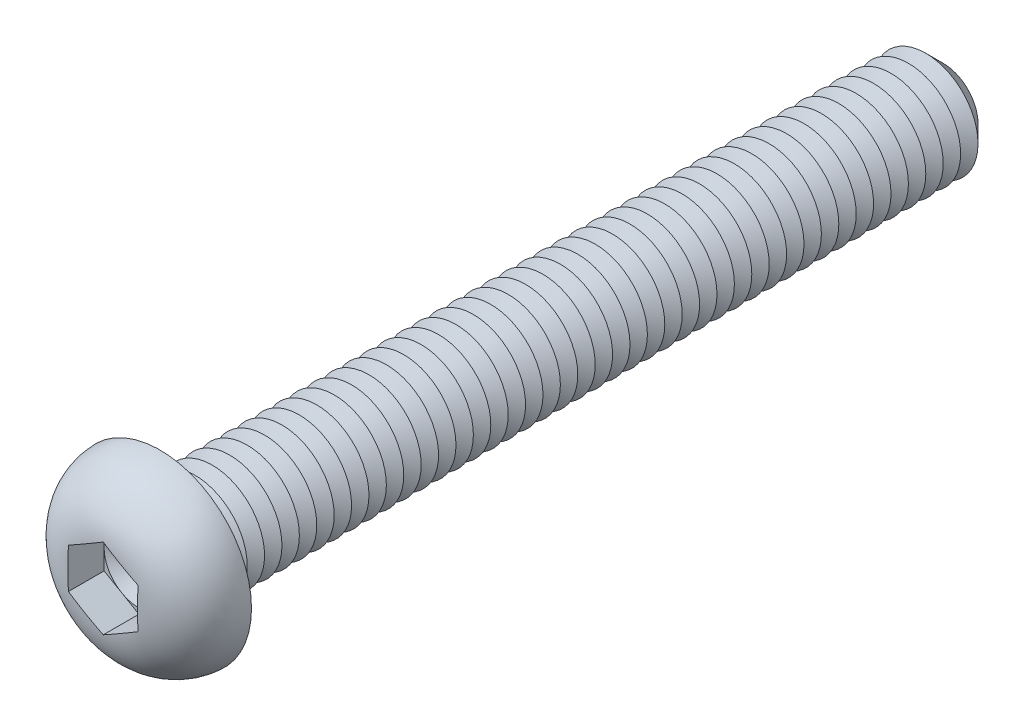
SolidWorks part; units mm, degrees
ref_plane "Front Plane" through (0, 0, 0) normal (0, 0, 1) x (1, 0, 0)
ref_plane "Top Plane" through (0, 0, 0) normal (0, 1, 0) x (1, 0, 0)
ref_plane "Right Plane" through (0, 0, 0) normal (1, 0, 0) x (0, 0, -1)
sketch "Sketch1" plane through (0, 0, 0) normal (1, 0, 0) x (0, 0, -1)
  line L0 (-47.9342, 0) -> (60.3146, 0) construction
sketch "Sketch2" plane through (0, 0, 0) normal (1, 0, 0) x (0, 0, -1)
  line L0 (0, 0) -> (-3.3, 0)
  line L1 (-47.9342, 0) -> (60.3146, 0) construction
  line L2 (-3.3, 0) -> (-3.3, 1.8515)
  line L3 (0, 5.25) -> (0, 0)
  arc A0 (-3.3, 1.8515) -> (0, 5.25) centre (0.1, 1.8515) cw
  dimension "D1" = 3.4
  dimension "D2" = 3.3
  dimension "D3" = 5.25
revolve "Revolve1" add sketch "Sketch2" angle 360 about L0
sketch "Sketch3" plane through (0, 0, 3.3) normal (0, 0, 1) x (1, 0, 0)
  line L1 (0, 2.3094) -> (-2, 1.1547)
  line L2 (-2, 1.1547) -> (-2, -1.1547)
  line L3 (-2, -1.1547) -> (0, -2.3094)
  line L4 (0, -2.3094) -> (2, -1.1547)
  line L5 (2, -1.1547) -> (2, 1.1547)
  line L6 (2, 1.1547) -> (0, 2.3094)
  circle A0 centre (0, 0) radius 2 construction
  dimension "D1" = 4
extrude "Cut-Extrude1" cut sketch "Sketch3" against normal blind 2.08
sketch "Sketch4" plane through (0, 0, 0) normal (0, 0, -1) x (-1, 0, 0)
  circle A0 centre (0, 0) radius 3
  dimension "D1" = 6
extrude "Boss-Extrude1" add sketch "Sketch4" along normal blind 45
chamfer "Chamfer1" distance 1 angle 45 1 edges at (-3, 0, -45)
sketch "Sketch5" plane through (0, 0, 0) normal (1, 0, 0) x (0, 0, -1)
  line L0 (1, 3) -> (2, 3)
  line L1 (44, 3) -> (0, 3) construction
  line L2 (2, 3) -> (1.5, 2.134)
  line L3 (1.5, 2.134) -> (1, 3)
  line L4 (0, -5.25) -> (0, 5.25) construction
  line L5 (44, 3) -> (0, 3) construction
  dimension "D1" = 1
  dimension "D2" = 1
revolve "Cut-Revolve1" cut sketch "Sketch5" angle 360 about L0
pattern_linear "LPattern1" count 43 spacing 1 along (0, 0, -1) of "Cut-Revolve1"
fillet "Fillet2" radius 0.5 1 edges at (-3, 0, 0)
sketch "Sketch6" plane through (0, 0, 1.22) normal (0, 0, 1) x (1, 0, 0)
  line L0 (0, -2.3094) -> (2, -1.1547) construction
  circle A0 centre (0, 0) radius 2
extrude "Cut-Extrude2" cut sketch "Sketch6" against normal through all draft 60
